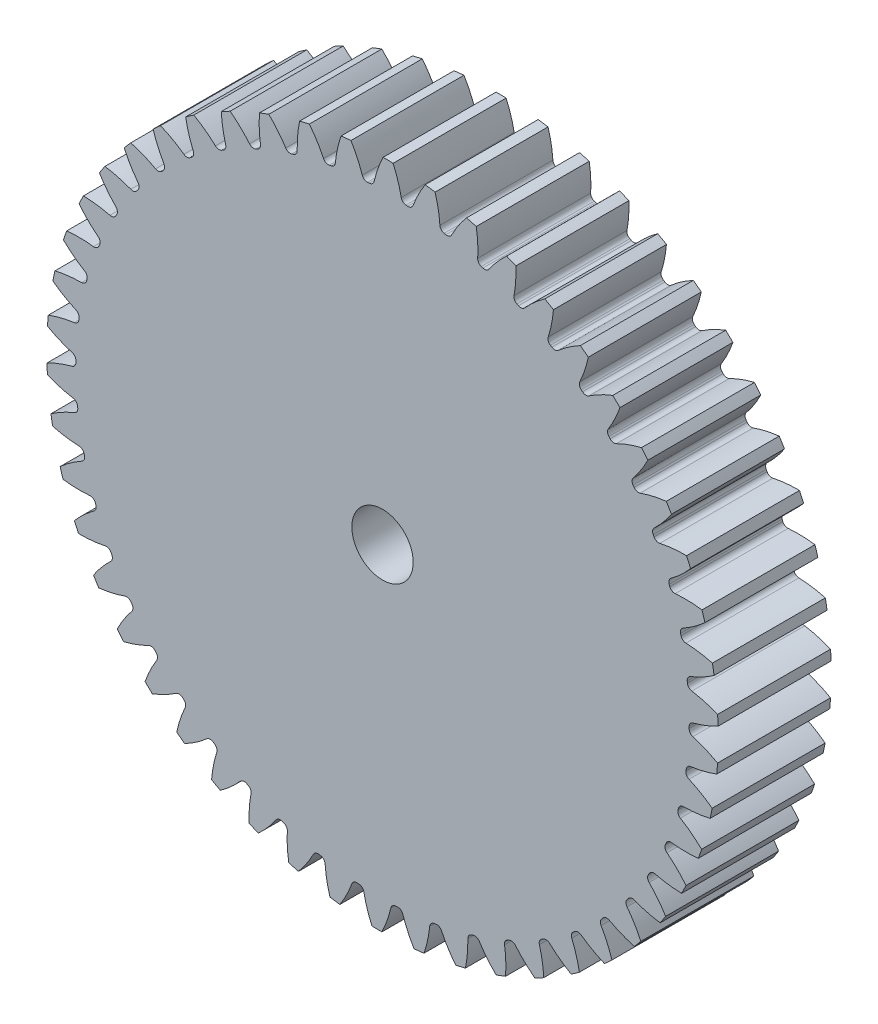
SolidWorks part; units mm, degrees
ref_plane "Front" through (0, 0, 0) normal (0, 0, 1) x (1, 0, 0)
ref_plane "Top" through (0, 0, 0) normal (0, 1, 0) x (1, 0, 0)
ref_plane "Right" through (0, 0, 0) normal (1, 0, 0) x (0, 0, -1)
sketch "Sketch3" plane through (0, 0, 0) normal (0, 0, 1) x (1, 0, 0)
  circle A0 centre (0, 0) radius 264.16
  dimension "od" = 528.32
extrude "gearBody" add sketch "Sketch3" along normal blind 88.9
sketch "Sketch2" plane through (0, 0, 0) normal (0, 0, 1) x (1, 0, 0)
  line L0 (0, 0) -> (220.5133, 91.3396) construction
  line L1 (263.7362, -17.1162) -> (0, 0) construction
  line L2 (0, 0) -> (36.3143, 0) construction
  line L3 (253.9728, 3.7176) -> (253.708, -12.1762) construction
  line L5 (253.8404, -4.2293) -> (0, 0) construction
  line L7 (0, 0) -> (238.6819, 0) construction
  arc A0 (238.681, -0.6772) -> (238.571, -7.2744) centre (0, 0) ccw construction
  arc A1 (264.031, 8.2531) -> (263.6096, -17.0442) centre (0, 0) ccw construction
  arc A2 (253.9728, 3.7176) -> (253.708, -12.1762) centre (0, 0) ccw construction
  arc A3 (241.2537, -4.7258) -> (241.2772, -3.3137) centre (0, 0) ccw
  arc A4 (263.7362, -17.1162) -> (244.204, -8.7688) centre (217.3481, -98.6349) ccw
  arc A5 (263.7362, -17.1162) -> (264.16, 8.3208) centre (0, 0) ccw
  arc A6 (264.16, 8.3208) -> (244.3606, 0.6287) centre (220.5133, 91.3396) cw
  arc A7 (241.2772, -3.3137) -> (244.3606, 0.6287) centre (245.412, -3.3705) cw
  arc A8 (244.204, -8.7688) -> (241.2537, -4.7258) centre (245.388, -4.8068) cw
  point P6 (264.16, 8.3208)
  point P22 (263.7362, -17.1162)
  dimension "baseDia" = 477.3639
  dimension "od" = 528.32
  dimension "pd" = 508
  dimension "rd" = 482.6
  dimension "rFillet" = 4.1351
  dimension "pointX" = 264.16
  dimension "pointY" = 8.3208
  dimension "CTT" = 15.8937
  dimension "flankCenterAngle" = 22.5
extrude "toothCut" cut sketch "Sketch2" along normal through all
pattern_circular "CirPattern1" count 50 over 360 about axis through (0, 0, 0) along (0, 0, 1) of "toothCut"
sketch "hub1Dia" plane through (0, 0, 0) normal (0, 0, -1) x (-1, 0, 0)
  circle A0 centre (0, 0) radius 12.7
  dimension "hub1Dia" = 25.4
sketch "hub2Dia" plane through (0, 0, 88.9) normal (0, 0, 1) x (1, 0, 0)
  circle A0 centre (0, 0) radius 12.7
  dimension "hub2dia" = 25.4
sketch "boreDia" plane through (0, 0, 0) normal (0, 0, 1) x (1, 0, 0)
  circle A0 centre (0, 0) radius 24.13
  dimension "boreDia" = 48.26
extrude "bore" cut sketch "boreDia" against normal mid plane 25400
